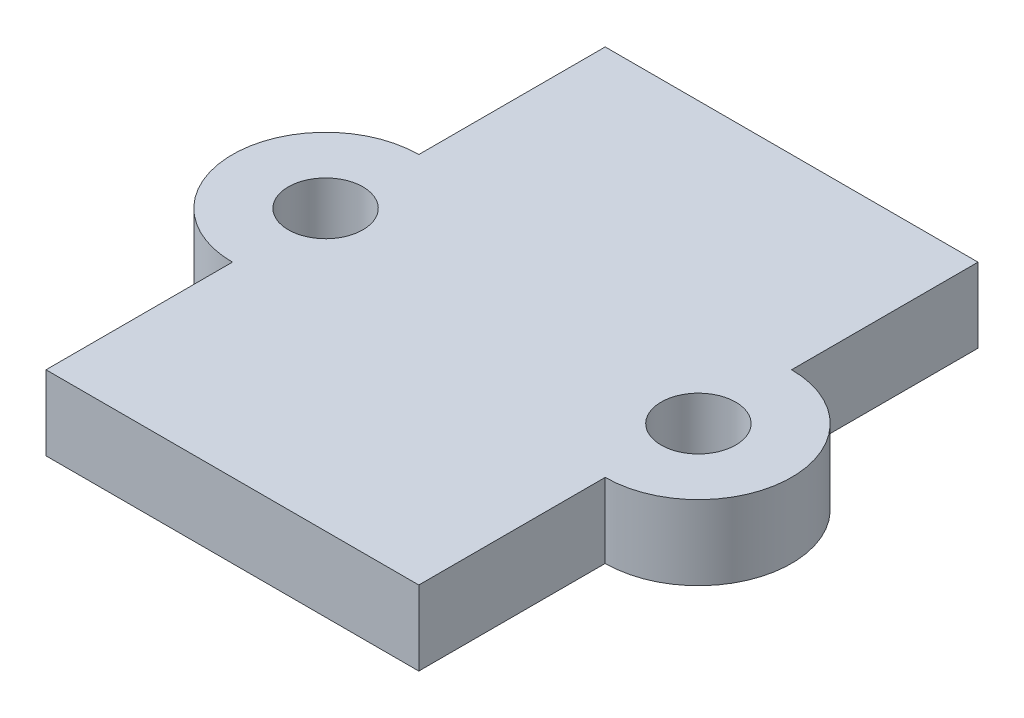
SolidWorks part; units mm, degrees
ref_plane "Front Plane" through (0, 0, 0) normal (0, 0, 1) x (1, 0, 0)
ref_plane "Top Plane" through (0, 0, 0) normal (0, 1, 0) x (1, 0, 0)
ref_plane "Right Plane" through (0, 0, 0) normal (1, 0, 0) x (0, 0, -1)
sketch "Sketch1" plane through (0, 0, 0) normal (0, 1, 0) x (1, 0, 0)
  line L1 (-5, -7.5) -> (5, -7.5)
  line L2 (-5, -7.5) -> (-5, 7.5)
  line L3 (-5, 7.5) -> (5, 7.5)
  line L4 (5, -7.5) -> (5, 7.5)
  line L5 (-5, -7.5) -> (5, 7.5) construction
  line L6 (-5, 7.5) -> (5, -7.5) construction
  point P0 (0, 0)
  dimension "D1" = 10
  dimension "D2" = 15
extrude "Boss-Extrude1" add sketch "Sketch1" along normal blind 2
sketch "Sketch2" plane through (0, 2, 0) normal (0, 1, 0) x (1, 0, 0)
  line L0 (-5, 0) -> (5, 0) construction
  line L1 (-5, 2.5) -> (5, 2.5)
  line L2 (-5, -2.5) -> (5, -2.5)
  line L3 (-5, 7.5) -> (-5, -7.5) construction
  arc A0 (-5, 2.5) -> (-5, -2.5) centre (-5, 0) ccw
  arc A1 (5, -2.5) -> (5, 2.5) centre (5, 0) ccw
  circle A2 centre (5, 0) radius 1
  circle A3 centre (-5, 0) radius 1
  point P2 (0, 0)
  point P12 (-5, 0)
  dimension "D1" = 2.5
  dimension "D2" = 2
extrude "Boss-Extrude2" add sketch "Sketch2" against normal blind 2 contours L2 A1 L1 A0
sketch "Sketch3" plane through (0, 0, 0) normal (0, -1, 0) x (1, 0, 0)
  line L2 (-5, -2.5) -> (5, -2.5)
  line L3 (5, 2.5) -> (-5, 2.5)
  line L4 (-5, -2.5) -> (5, -2.5)
  line L5 (5, 2.5) -> (-5, 2.5)
  circle A1 centre (-5, 0) radius 1
  circle A2 centre (-5, 0) radius 1
  circle A3 centre (5, 0) radius 1
  circle A4 centre (5, 0) radius 1
  arc A6 (5, -2.5) -> (5, 2.5) centre (5, 0) ccw
  arc A7 (-5, 2.5) -> (-5, -2.5) centre (-5, 0) ccw
  arc A8 (5, -2.5) -> (5, 2.5) centre (5, 0) ccw
  arc A9 (-5, 2.5) -> (-5, -2.5) centre (-5, 0) ccw
  dimension "D1" = 0
  dimension "D2" = 0
  dimension "D3" = 0
extrude "Cut-Extrude1" cut sketch "Sketch3" against normal blind 2 contours A4 | A2
